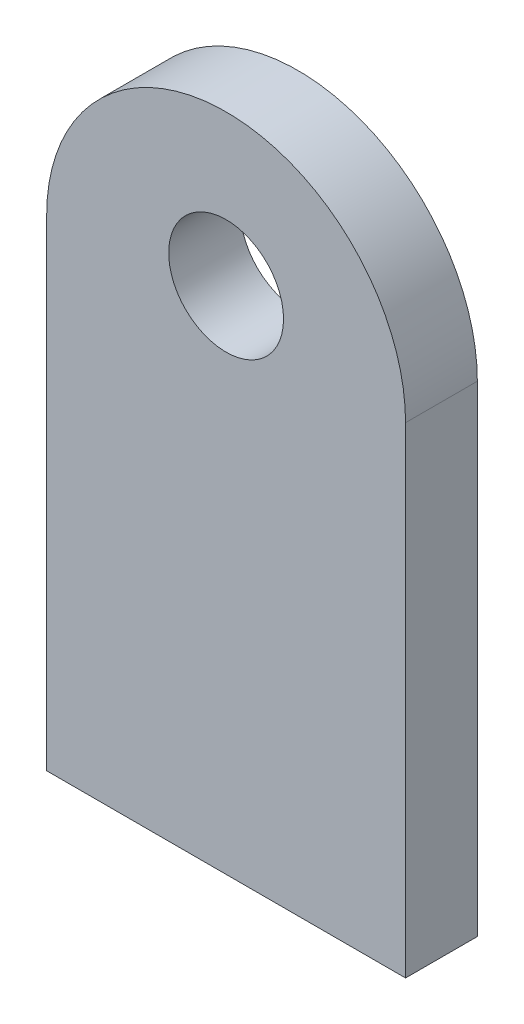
SolidWorks part; units mm, degrees
ref_plane "Plan de face" through (0, 0, 0) normal (0, 0, 1) x (1, 0, 0)
ref_plane "Plan de dessus" through (0, 0, 0) normal (0, 1, 0) x (1, 0, 0)
ref_plane "Plan de droite" through (0, 0, 0) normal (1, 0, 0) x (0, 0, -1)
sketch "Esquisse1" plane through (0, 0, 0) normal (0, 0, 1) x (1, 0, 0)
  line L0 (-12.5, 0) -> (12.5, 0)
  line L1 (12.5, 0) -> (12.5, 33.5)
  line L2 (-12.5, 33.5) -> (-12.5, 0)
  arc A0 (12.5, 33.5) -> (-12.5, 33.5) centre (0, 33.5) ccw
  point P6 (0, 0)
  dimension "D2" = 46
  dimension "D1" = 25
extrude "Boss.-Extru.1" add sketch "Esquisse1" along normal blind 5
hole_wizard "Diamètre du perçage Ø8.0 (8)1" positions "Esquisse3" profile "Esquisse2" hole size "Ø8.0" standard "ISO"
sketch "Esquisse3" plane through (0, 0, 5) normal (0, 0, 1) x (1, 0, 0)
  arc A0 (12.5, 33.5) -> (-12.5, 33.5) centre (0, 33.5) ccw construction
  point P0 (0, 35.5)
  dimension "D1" = 2
sketch "Esquisse2" plane through (0, 35.5, 5) normal (1, 0, 0) x (0, -1, 0)
  line L0 (0, 0) -> (0, 5)
  line L1 (0, 5) -> (4, 5)
  line L2 (4, 5) -> (4, 0)
  line L5 (4, 0) -> (0, 0)
  line L11 (0, -6.35) -> (0, 107.95) construction
  dimension "Diamètre du perçage jusqu'au prochain" = 8
  dimension "Profondeur du perçage jusqu'au prochain" = 5
